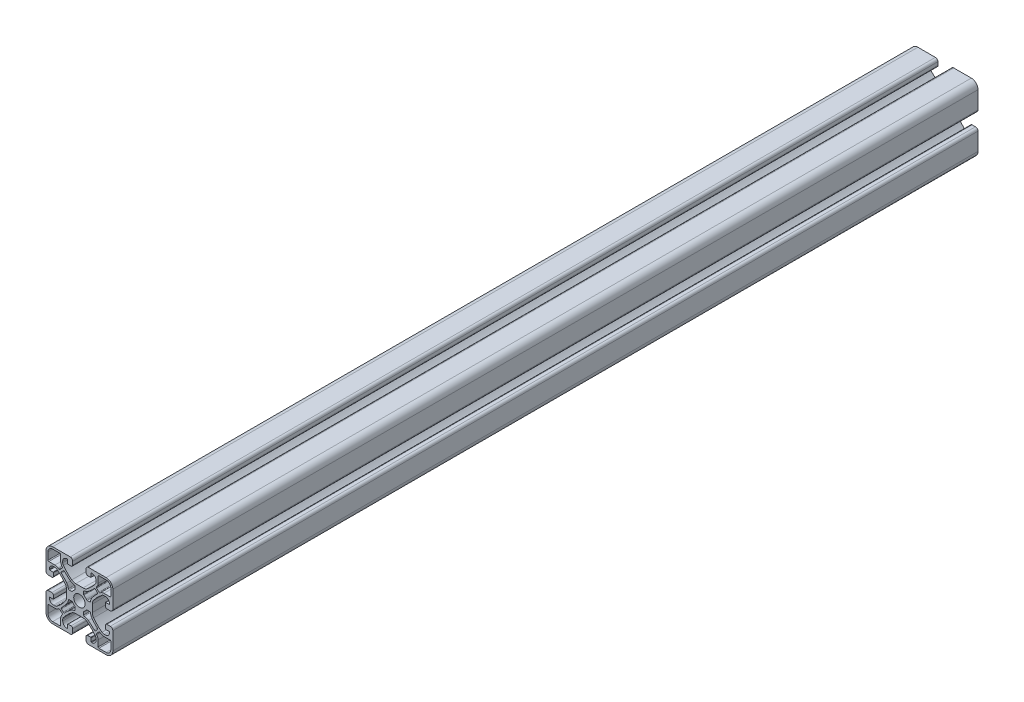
SolidWorks part; units mm, degrees
ref_plane "Face" through (0, 0, 0) normal (0, 0, 1) x (1, 0, 0)
ref_plane "Dessus" through (0, 0, 0) normal (0, 1, 0) x (1, 0, 0)
ref_plane "Droite" through (0, 0, 0) normal (1, 0, 0) x (0, 0, -1)
sketch "Esquisse profilé" plane through (0, 0, 0) normal (0, 0, 1) x (1, 0, 0)
  line L0 (11.6997, 18.8) -> (16, 18.8)
  line L1 (18.8, 16) -> (18.8, 11.7)
  line L2 (18.3, 11.2) -> (14.67, 11.2)
  line L3 (12.3957, 10.2874) -> (12.7389, 10.5517)
  line L4 (11.7339, 10.3275) -> (10.3272, 11.7342)
  line L5 (10.5513, 12.7393) -> (10.2871, 12.3961)
  line L6 (11.1997, 14.6704) -> (11.1997, 18.3)
  line L7 (-11.1997, 14.6699) -> (-11.1997, 18.3)
  line L8 (-10.5517, 12.7393) -> (-10.2874, 12.3961)
  line L9 (-11.7342, 10.3275) -> (-10.3275, 11.7342)
  line L10 (-12.3961, 10.2874) -> (-12.7393, 10.5517)
  line L11 (-18.3, 11.2) -> (-14.6704, 11.2)
  line L12 (-18.8, 16) -> (-18.8, 11.7)
  line L13 (-11.6997, 18.8) -> (-16, 18.8)
  line L14 (-2.5, 6.0982) -> (-2.5, 4.6098)
  line L15 (-4.6098, 2.5) -> (-6.0982, 2.5)
  line L16 (-10.7615, 9.6032) -> (-9.6032, 10.7615)
  line L17 (-10.7615, -9.6032) -> (-9.6032, -10.7615)
  line L18 (-4.6098, -2.5) -> (-6.0982, -2.5)
  line L19 (-2.5, -6.0982) -> (-2.5, -4.6098)
  line L20 (-11.7, -18.8) -> (-16, -18.8)
  line L21 (-18.8, -16) -> (-18.8, -11.7)
  line L22 (-18.3, -11.2) -> (-14.6704, -11.2)
  line L23 (-12.3961, -10.2874) -> (-12.7393, -10.5517)
  line L24 (-11.7342, -10.3275) -> (-10.3275, -11.7342)
  line L25 (-10.5517, -12.7393) -> (-10.2874, -12.3961)
  line L26 (-11.2, -14.6704) -> (-11.2, -18.3)
  line L27 (9.6032, 10.7615) -> (10.7615, 9.6032)
  line L28 (6.0982, 2.5) -> (4.6098, 2.5)
  line L29 (2.5, 4.6098) -> (2.5, 6.0982)
  line L30 (2.5, -4.6098) -> (2.5, -6.0982)
  line L31 (6.0982, -2.5) -> (4.6098, -2.5)
  line L32 (9.6032, -10.7615) -> (10.7615, -9.6032)
  line L33 (11.1997, -14.6704) -> (11.1997, -18.3)
  line L34 (10.5513, -12.7393) -> (10.2871, -12.3961)
  line L35 (11.7339, -10.3275) -> (10.3272, -11.7342)
  line L36 (12.3957, -10.2874) -> (12.7389, -10.5517)
  line L37 (18.3, -11.2) -> (14.67, -11.2)
  line L38 (18.8, -16) -> (18.8, -11.7)
  line L39 (11.6997, -18.8) -> (16, -18.8)
  line L40 (5.5, -20) -> (16, -20)
  line L41 (4, -16.5) -> (4, -18.5)
  line L42 (6.75, -15.5) -> (5, -15.5)
  line L43 (7, -17.75) -> (7, -15.75)
  line L44 (7.5, -18) -> (7.25, -18)
  line L45 (10, -14.7204) -> (10, -15.5)
  line L46 (-2.1931, -7.75) -> (2.1931, -7.75)
  line L47 (-10, -15.5) -> (-10, -14.7204)
  line L48 (-7.25, -18) -> (-7.5, -18)
  line L49 (-7, -15.75) -> (-7, -17.75)
  line L50 (-5, -15.5) -> (-6.75, -15.5)
  line L51 (-4, -18.5) -> (-4, -16.5)
  line L52 (-16, -20) -> (-5.5, -20)
  line L53 (-20, -5.5) -> (-20, -16)
  line L54 (-16.5, -4) -> (-18.5, -4)
  line L55 (-15.5, -6.75) -> (-15.5, -5)
  line L56 (-17.75, -7) -> (-15.75, -7)
  line L57 (-18, -7.5) -> (-18, -7.25)
  line L58 (-14.7204, -10) -> (-15.5, -10)
  line L59 (-7.75, 2.1931) -> (-7.75, -2.1931)
  line L60 (-15.5, 10) -> (-14.7204, 10)
  line L61 (-18, 7.25) -> (-18, 7.5)
  line L62 (-15.75, 7) -> (-17.75, 7)
  line L63 (-15.5, 5) -> (-15.5, 6.75)
  line L64 (-18.5, 4) -> (-16.5, 4)
  line L65 (-20, 16) -> (-20, 5.5)
  line L66 (-5.5, 20) -> (-16, 20)
  line L67 (-4, 16.5) -> (-4, 18.5)
  line L68 (-6.75, 15.5) -> (-5, 15.5)
  line L69 (-7, 17.75) -> (-7, 15.75)
  line L70 (-7.5, 18) -> (-7.25, 18)
  line L71 (-10, 14.7204) -> (-10, 15.5)
  line L72 (2.1931, 7.75) -> (-2.1931, 7.75)
  line L73 (10, 15.5) -> (10, 14.7204)
  line L74 (7.25, 18) -> (7.5, 18)
  line L75 (7, 15.75) -> (7, 17.75)
  line L76 (5, 15.5) -> (6.75, 15.5)
  line L77 (4, 18.5) -> (4, 16.5)
  line L78 (16, 20) -> (5.5, 20)
  line L79 (20, 5.5) -> (20, 16)
  line L80 (16.5, 4) -> (18.5, 4)
  line L81 (15.5, 6.75) -> (15.5, 5)
  line L82 (17.75, 7) -> (15.75, 7)
  line L83 (18, 7.5) -> (18, 7.25)
  line L84 (14.7204, 10) -> (15.5, 10)
  line L85 (7.75, -2.1931) -> (7.75, 2.1931)
  line L86 (15.5, -10) -> (14.7204, -10)
  line L87 (18, -7.25) -> (18, -7.5)
  line L88 (15.75, -7) -> (17.75, -7)
  line L89 (15.5, -5) -> (15.5, -6.75)
  line L90 (18.5, -4) -> (16.5, -4)
  line L91 (20, -16) -> (20, -5.5)
  arc A0 (11.1997, 18.3) -> (11.6997, 18.8) centre (11.6997, 18.3) cw
  arc A1 (-11.1997, 14.6699) -> (-10.5517, 12.7393) centre (-7.9997, 14.6699) ccw
  arc A2 (16, 18.8) -> (18.8, 16) centre (16, 16) cw
  arc A3 (18.8, 11.7) -> (18.3, 11.2) centre (18.3, 11.7) cw
  arc A4 (12.7389, 10.5517) -> (14.67, 11.2) centre (14.67, 8) cw
  arc A5 (12.3957, 10.2874) -> (11.7339, 10.3275) centre (12.0874, 10.6811) cw
  arc A6 (10.3272, 11.7342) -> (10.2871, 12.3961) centre (10.6807, 12.0878) cw
  arc A7 (11.1997, 14.6704) -> (10.5513, 12.7393) centre (7.9997, 14.6704) cw
  arc A8 (-10.3275, 11.7342) -> (-10.2874, 12.3961) centre (-10.6811, 12.0878) ccw
  arc A9 (-12.3961, 10.2874) -> (-11.7342, 10.3275) centre (-12.0878, 10.6811) ccw
  arc A10 (-12.7393, 10.5517) -> (-14.6704, 11.2) centre (-14.6704, 8) ccw
  arc A11 (-18.8, 11.7) -> (-18.3, 11.2) centre (-18.3, 11.7) ccw
  arc A12 (-16, 18.8) -> (-18.8, 16) centre (-16, 16) ccw
  arc A13 (-11.1997, 18.3) -> (-11.6997, 18.8) centre (-11.6997, 18.3) ccw
  arc A14 (-8.8828, 10.7477) -> (-5.38, 7.59) centre (10.34, 28.55) ccw
  arc A15 (-5.38, 7.59) -> (-2.9351, 6.594) centre (-2.26, 11.75) ccw
  arc A16 (-2.5, 6.0982) -> (-2.9351, 6.594) centre (-3, 6.0982) ccw
  arc A17 (-2.7273, 4.1907) -> (-2.5, 4.6098) centre (-3, 4.6098) ccw
  arc A18 (-2.7273, 4.1907) -> (-4.1907, 2.7273) centre (0, 0) ccw
  arc A19 (-4.6098, 2.5) -> (-4.1907, 2.7273) centre (-4.6098, 3) ccw
  arc A20 (-6.594, 2.9351) -> (-6.0982, 2.5) centre (-6.0982, 3) ccw
  arc A21 (-6.594, 2.9351) -> (-7.59, 5.38) centre (-11.75, 2.26) ccw
  arc A22 (-7.59, 5.38) -> (-10.7477, 8.8828) centre (-28.55, -10.34) ccw
  arc A23 (-10.7615, 9.6032) -> (-10.7477, 8.8828) centre (-10.4079, 9.2497) ccw
  arc A24 (-8.8828, 10.7477) -> (-9.6032, 10.7615) centre (-9.2497, 10.4079) ccw
  arc A25 (-8.8828, -10.7477) -> (-9.6032, -10.7615) centre (-9.2497, -10.4079) cw
  arc A26 (-10.7615, -9.6032) -> (-10.7477, -8.8828) centre (-10.4079, -9.2497) cw
  arc A27 (-7.59, -5.38) -> (-10.7477, -8.8828) centre (-28.55, 10.34) cw
  arc A28 (-6.594, -2.9351) -> (-7.59, -5.38) centre (-11.75, -2.26) cw
  arc A29 (-6.594, -2.9351) -> (-6.0982, -2.5) centre (-6.0982, -3) cw
  arc A30 (-4.6098, -2.5) -> (-4.1907, -2.7273) centre (-4.6098, -3) cw
  arc A31 (-2.7273, -4.1907) -> (-4.1907, -2.7273) centre (0, 0) cw
  arc A32 (-2.7273, -4.1907) -> (-2.5, -4.6098) centre (-3, -4.6098) cw
  arc A33 (-2.5, -6.0982) -> (-2.9351, -6.594) centre (-3, -6.0982) cw
  arc A34 (-5.38, -7.59) -> (-2.9351, -6.594) centre (-2.26, -11.75) cw
  arc A35 (-8.8828, -10.7477) -> (-5.38, -7.59) centre (10.34, -28.55) cw
  arc A36 (-11.2, -18.3) -> (-11.7, -18.8) centre (-11.7, -18.3) cw
  arc A37 (-16, -18.8) -> (-18.8, -16) centre (-16, -16) cw
  arc A38 (-18.8, -11.7) -> (-18.3, -11.2) centre (-18.3, -11.7) cw
  arc A39 (-12.7393, -10.5517) -> (-14.6704, -11.2) centre (-14.6704, -8) cw
  arc A40 (-12.3961, -10.2874) -> (-11.7342, -10.3275) centre (-12.0878, -10.6811) cw
  arc A41 (-10.3275, -11.7342) -> (-10.2874, -12.3961) centre (-10.6811, -12.0878) cw
  arc A42 (-11.2, -14.6704) -> (-10.5517, -12.7393) centre (-8, -14.6704) cw
  arc A43 (10.7477, 8.8828) -> (10.7615, 9.6032) centre (10.4079, 9.2497) ccw
  arc A44 (10.7477, 8.8828) -> (7.59, 5.38) centre (28.55, -10.34) ccw
  arc A45 (7.59, 5.38) -> (6.594, 2.9351) centre (11.75, 2.26) ccw
  arc A46 (6.0982, 2.5) -> (6.594, 2.9351) centre (6.0982, 3) ccw
  arc A47 (4.1907, 2.7273) -> (4.6098, 2.5) centre (4.6098, 3) ccw
  arc A48 (4.1907, 2.7273) -> (2.7273, 4.1907) centre (0, 0) ccw
  arc A49 (2.5, 4.6098) -> (2.7273, 4.1907) centre (3, 4.6098) ccw
  arc A50 (2.9351, 6.594) -> (2.5, 6.0982) centre (3, 6.0982) ccw
  arc A51 (2.9351, 6.594) -> (5.38, 7.59) centre (2.26, 11.75) ccw
  arc A52 (5.38, 7.59) -> (8.8828, 10.7477) centre (-10.34, 28.55) ccw
  arc A53 (9.6032, 10.7615) -> (8.8828, 10.7477) centre (9.2497, 10.4079) ccw
  arc A54 (9.6032, -10.7615) -> (8.8828, -10.7477) centre (9.2497, -10.4079) cw
  arc A55 (5.38, -7.59) -> (8.8828, -10.7477) centre (-10.34, -28.55) cw
  arc A56 (2.9351, -6.594) -> (5.38, -7.59) centre (2.26, -11.75) cw
  arc A57 (2.9351, -6.594) -> (2.5, -6.0982) centre (3, -6.0982) cw
  arc A58 (2.5, -4.6098) -> (2.7273, -4.1907) centre (3, -4.6098) cw
  arc A59 (4.1907, -2.7273) -> (2.7273, -4.1907) centre (0, 0) cw
  arc A60 (4.1907, -2.7273) -> (4.6098, -2.5) centre (4.6098, -3) cw
  arc A61 (6.0982, -2.5) -> (6.594, -2.9351) centre (6.0982, -3) cw
  arc A62 (7.59, -5.38) -> (6.594, -2.9351) centre (11.75, -2.26) cw
  arc A63 (10.7477, -8.8828) -> (7.59, -5.38) centre (28.55, 10.34) cw
  arc A64 (10.7477, -8.8828) -> (10.7615, -9.6032) centre (10.4079, -9.2497) cw
  arc A65 (11.1997, -14.6704) -> (10.5513, -12.7393) centre (7.9997, -14.6704) ccw
  arc A66 (10.3272, -11.7342) -> (10.2871, -12.3961) centre (10.6807, -12.0878) ccw
  arc A67 (12.3957, -10.2874) -> (11.7339, -10.3275) centre (12.0874, -10.6811) ccw
  arc A68 (12.7389, -10.5517) -> (14.67, -11.2) centre (14.67, -8) ccw
  arc A69 (18.8, -11.7) -> (18.3, -11.2) centre (18.3, -11.7) ccw
  arc A70 (16, -18.8) -> (18.8, -16) centre (16, -16) ccw
  arc A71 (11.1997, -18.3) -> (11.6997, -18.8) centre (11.6997, -18.3) ccw
  circle A72 centre (0, 0) radius 3.4
  arc A73 (16, -20) -> (20, -16) centre (16, -16) ccw
  arc A74 (4, -18.5) -> (5.5, -20) centre (5.5, -18.5) ccw
  arc A75 (5, -15.5) -> (4, -16.5) centre (5, -16.5) ccw
  arc A76 (7, -15.75) -> (6.75, -15.5) centre (6.75, -15.75) ccw
  arc A77 (7, -17.75) -> (7.25, -18) centre (7.25, -17.75) ccw
  arc A78 (7.5, -18) -> (10, -15.5) centre (7.5, -15.5) ccw
  arc A79 (10, -14.7204) -> (9.5948, -13.5134) centre (8, -14.7204) ccw
  arc A80 (9.5948, -13.5134) -> (4.5803, -8.5405) centre (-10.34, -28.6) ccw
  arc A81 (4.5803, -8.5405) -> (2.1931, -7.75) centre (2.1931, -11.75) ccw
  arc A82 (-2.1931, -7.75) -> (-4.5803, -8.5405) centre (-2.1931, -11.75) ccw
  arc A83 (-4.5803, -8.5405) -> (-9.5948, -13.5134) centre (10.34, -28.6) ccw
  arc A84 (-9.5948, -13.5134) -> (-10, -14.7204) centre (-8, -14.7204) ccw
  arc A85 (-10, -15.5) -> (-7.5, -18) centre (-7.5, -15.5) ccw
  arc A86 (-7.25, -18) -> (-7, -17.75) centre (-7.25, -17.75) ccw
  arc A87 (-6.75, -15.5) -> (-7, -15.75) centre (-6.75, -15.75) ccw
  arc A88 (-4, -16.5) -> (-5, -15.5) centre (-5, -16.5) ccw
  arc A89 (-5.5, -20) -> (-4, -18.5) centre (-5.5, -18.5) ccw
  arc A90 (-20, -16) -> (-16, -20) centre (-16, -16) ccw
  arc A91 (-18.5, -4) -> (-20, -5.5) centre (-18.5, -5.5) ccw
  arc A92 (-15.5, -5) -> (-16.5, -4) centre (-16.5, -5) ccw
  arc A93 (-15.75, -7) -> (-15.5, -6.75) centre (-15.75, -6.75) ccw
  arc A94 (-17.75, -7) -> (-18, -7.25) centre (-17.75, -7.25) ccw
  arc A95 (-18, -7.5) -> (-15.5, -10) centre (-15.5, -7.5) ccw
  arc A96 (-14.7204, -10) -> (-13.5134, -9.5948) centre (-14.7204, -8) ccw
  arc A97 (-13.5134, -9.5948) -> (-8.5405, -4.5803) centre (-28.6, 10.34) ccw
  arc A98 (-8.5405, -4.5803) -> (-7.75, -2.1931) centre (-11.75, -2.1931) ccw
  arc A99 (-7.75, 2.1931) -> (-8.5405, 4.5803) centre (-11.75, 2.1931) ccw
  arc A100 (-8.5405, 4.5803) -> (-13.5134, 9.5948) centre (-28.6, -10.34) ccw
  arc A101 (-13.5134, 9.5948) -> (-14.7204, 10) centre (-14.7204, 8) ccw
  arc A102 (-15.5, 10) -> (-18, 7.5) centre (-15.5, 7.5) ccw
  arc A103 (-18, 7.25) -> (-17.75, 7) centre (-17.75, 7.25) ccw
  arc A104 (-15.5, 6.75) -> (-15.75, 7) centre (-15.75, 6.75) ccw
  arc A105 (-16.5, 4) -> (-15.5, 5) centre (-16.5, 5) ccw
  arc A106 (-20, 5.5) -> (-18.5, 4) centre (-18.5, 5.5) ccw
  arc A107 (-16, 20) -> (-20, 16) centre (-16, 16) ccw
  arc A108 (-4, 18.5) -> (-5.5, 20) centre (-5.5, 18.5) ccw
  arc A109 (-5, 15.5) -> (-4, 16.5) centre (-5, 16.5) ccw
  arc A110 (-7, 15.75) -> (-6.75, 15.5) centre (-6.75, 15.75) ccw
  arc A111 (-7, 17.75) -> (-7.25, 18) centre (-7.25, 17.75) ccw
  arc A112 (-7.5, 18) -> (-10, 15.5) centre (-7.5, 15.5) ccw
  arc A113 (-10, 14.7204) -> (-9.5948, 13.5134) centre (-8, 14.7204) ccw
  arc A114 (-9.5948, 13.5134) -> (-4.5803, 8.5405) centre (10.34, 28.6) ccw
  arc A115 (-4.5803, 8.5405) -> (-2.1931, 7.75) centre (-2.1931, 11.75) ccw
  arc A116 (2.1931, 7.75) -> (4.5803, 8.5405) centre (2.1931, 11.75) ccw
  arc A117 (4.5803, 8.5405) -> (9.5948, 13.5134) centre (-10.34, 28.6) ccw
  arc A118 (9.5948, 13.5134) -> (10, 14.7204) centre (8, 14.7204) ccw
  arc A119 (10, 15.5) -> (7.5, 18) centre (7.5, 15.5) ccw
  arc A120 (7.25, 18) -> (7, 17.75) centre (7.25, 17.75) ccw
  arc A121 (6.75, 15.5) -> (7, 15.75) centre (6.75, 15.75) ccw
  arc A122 (4, 16.5) -> (5, 15.5) centre (5, 16.5) ccw
  arc A123 (5.5, 20) -> (4, 18.5) centre (5.5, 18.5) ccw
  arc A124 (20, 16) -> (16, 20) centre (16, 16) ccw
  arc A125 (18.5, 4) -> (20, 5.5) centre (18.5, 5.5) ccw
  arc A126 (15.5, 5) -> (16.5, 4) centre (16.5, 5) ccw
  arc A127 (15.75, 7) -> (15.5, 6.75) centre (15.75, 6.75) ccw
  arc A128 (17.75, 7) -> (18, 7.25) centre (17.75, 7.25) ccw
  arc A129 (18, 7.5) -> (15.5, 10) centre (15.5, 7.5) ccw
  arc A130 (14.7204, 10) -> (13.5134, 9.5948) centre (14.7204, 8) ccw
  arc A131 (13.5134, 9.5948) -> (8.5405, 4.5803) centre (28.6, -10.34) ccw
  arc A132 (8.5405, 4.5803) -> (7.75, 2.1931) centre (11.75, 2.1931) ccw
  arc A133 (7.75, -2.1931) -> (8.5405, -4.5803) centre (11.75, -2.1931) ccw
  arc A134 (8.5405, -4.5803) -> (13.5134, -9.5948) centre (28.6, 10.34) ccw
  arc A135 (13.5134, -9.5948) -> (14.7204, -10) centre (14.7204, -8) ccw
  arc A136 (15.5, -10) -> (18, -7.5) centre (15.5, -7.5) ccw
  arc A137 (18, -7.25) -> (17.75, -7) centre (17.75, -7.25) ccw
  arc A138 (15.5, -6.75) -> (15.75, -7) centre (15.75, -6.75) ccw
  arc A139 (16.5, -4) -> (15.5, -5) centre (16.5, -5) ccw
  arc A140 (20, -5.5) -> (18.5, -4) centre (18.5, -5.5) ccw
extrude "Extrusion1" add sketch "Esquisse profilé" along normal blind 518
